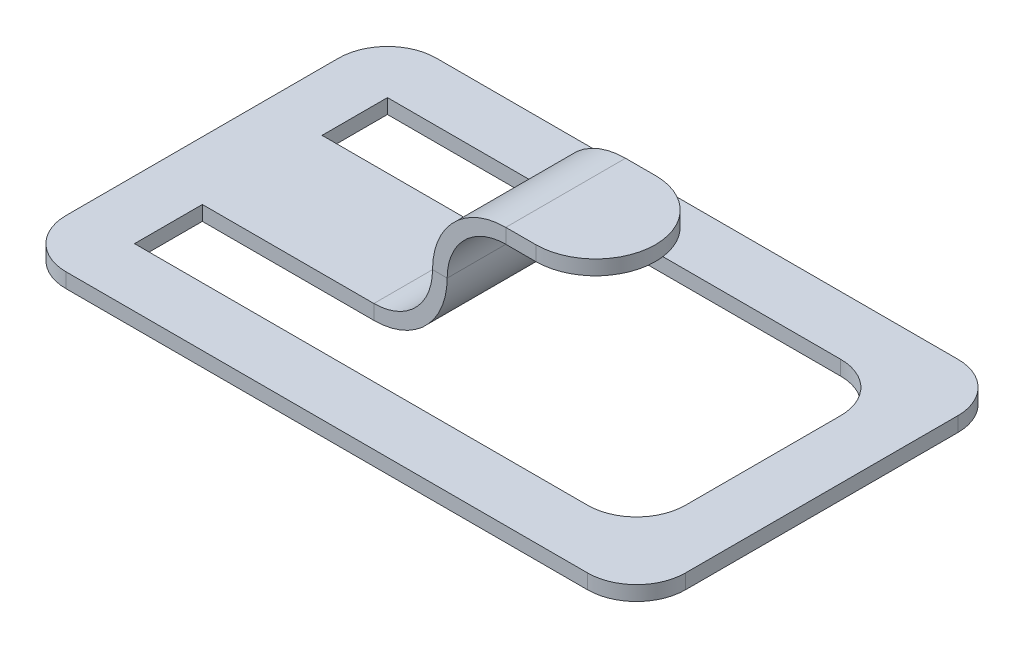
SolidWorks part; units mm, degrees
ref_plane "Alzado" through (0, 0, 0) normal (0, 0, 1) x (1, 0, 0)
ref_plane "Planta" through (0, 0, 0) normal (0, 1, 0) x (1, 0, 0)
ref_plane "Vista lateral" through (0, 0, 0) normal (1, 0, 0) x (0, 0, -1)
sketch "Croquis1" plane through (0, 0, 0) normal (0, 1, 0) x (1, 0, 0)
  line L0 (12, 63.7799) -> (104.762, 63.7799)
  line L1 (10, 0) -> (116.762, 0)
  line L2 (0, 10) -> (0, 65.7799)
  line L3 (10, 75.7799) -> (116.762, 75.7799)
  line L4 (126.762, 10) -> (126.762, 65.7799)
  line L5 (114.762, 22) -> (114.762, 53.7799)
  line L6 (12, 12) -> (104.762, 12)
  line L7 (12, 12) -> (12, 25.89)
  line L8 (114.762, 12) -> (114.762, 63.7799) construction
  line L9 (12, 63.7799) -> (114.762, 63.7799) construction
  line L10 (12, 12) -> (114.762, 12) construction
  line L11 (12, 50.3908) -> (12, 63.7799)
  line L12 (12, 25.89) -> (80.2466, 25.89)
  line L13 (12, 50.3908) -> (80.2466, 50.3908)
  line L14 (12, 12) -> (12, 63.7799) construction
  arc A0 (126.762, 65.7799) -> (116.762, 75.7799) centre (116.762, 65.7799) ccw
  arc A1 (116.762, 0) -> (126.762, 10) centre (116.762, 10) ccw
  arc A2 (0, 65.7799) -> (10, 75.7799) centre (10, 65.7799) cw
  arc A3 (10, 0) -> (0, 10) centre (10, 10) cw
  arc A4 (104.762, 12) -> (114.762, 22) centre (104.762, 22) ccw
  arc A5 (80.2466, 25.89) -> (80.2466, 50.3908) centre (80.2466, 38.1404) ccw
  arc A6 (12, 12) -> (12, 12) centre (12, 12) cw
  arc A7 (12, 63.7799) -> (12, 63.7799) centre (12, 63.7799) cw
  arc A8 (114.762, 53.7799) -> (104.762, 63.7799) centre (104.762, 53.7799) ccw
  arc A9 (114.762, 63.7799) -> (114.762, 63.7799) centre (114.762, 63.7799) ccw construction
  arc A10 (114.762, 12) -> (114.762, 12) centre (114.762, 12) ccw construction
  point P13 (0, 0)
  dimension "D1" = 10
  dimension "D3" = 10
  dimension "D2" = 12
sheet metal parameters "Chapa metálica1" thickness 3 parameters "D1"=12, "Espesor"=3
base flange "Brida base1" sketch "Croquis1" thickness 3 reverse thickness direction yes parameters "D1"=12
sketch "Croquis3" plane through (0, 3, 0) normal (0, 1, 0) x (1, 0, 0)
  line L0 (51.086, 56.1644) -> (51.086, 19.5659)
sketch "Croquis4" plane through (0, 3, 0) normal (0, 1, 0) x (1, 0, 0)
  line L0 (58.657, 58.7921) -> (58.657, 16.6224)
jog "Doble pliegue1" parameters "D1"=12
bend "Plegar doble pliegue1" bend radius 12 bend angle 90 parameters "D5"=1
bend "Plegar doble pliegue2" bend radius 12 bend angle 90 parameters "D5"=2
flat pattern "Chapa desplegada1"
sketch "Líneas de pliegue1" plane through (0, 0, 0) normal (0, 1, 0) x (-1, 0, 0)
bend of the flat pattern "Aplanar-<Plegar doble pliegue1>1"
bend of the flat pattern "Aplanar-<Plegar doble pliegue2>1"
